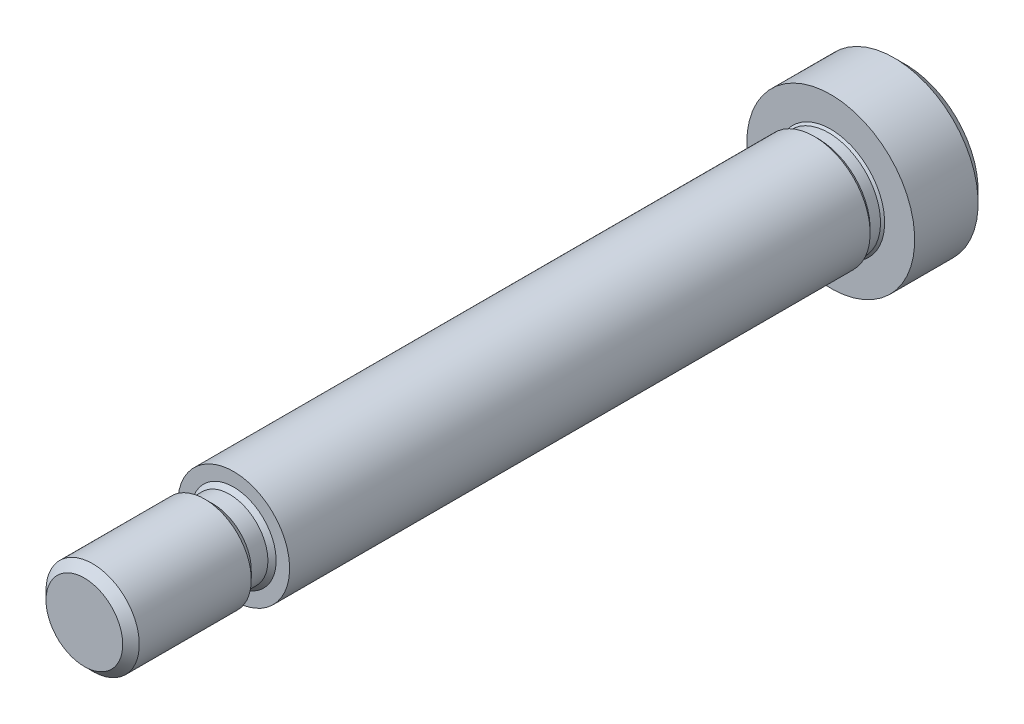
SolidWorks part; units mm, degrees
ref_plane "Front" through (0, 0, 0) normal (0, 0, 1) x (1, 0, 0)
ref_plane "Top" through (0, 0, 0) normal (0, 1, 0) x (1, 0, 0)
ref_plane "Right" through (0, 0, 0) normal (1, 0, 0) x (0, 0, -1)
sketch "Logo3_Revol_Axis" plane through (0, 0, 0) normal (0, 1, 0) x (1, 0, 0)
  line L0 (0, -25.3777) -> (0, 25.3777) construction
sketch "Logo3_bib1" plane through (0, 0, 0) normal (0, -1, 0) x (-1, 0, 0)
  line L0 (0, 62.3527) -> (0, -65.5595) construction
  line L1 (4.7625, 0) -> (3.6163, 0)
  line L2 (4.7625, 0) -> (4.7625, 49.3903)
  line L3 (4.7625, 49.3903) -> (4.4101, 49.7427)
  line L4 (7.1438, 56.1975) -> (6.1913, 57.15)
  line L5 (4.5863, 50.8) -> (7.1438, 50.8)
  line L6 (7.1438, 50.8) -> (7.1438, 56.1975)
  line L7 (6.1913, 57.15) -> (0, 57.15)
  line L8 (4.4101, 49.7427) -> (4.4101, 50.6238)
  line L9 (3.9688, -2.467) -> (3.9688, -11.9951)
  line L11 (3.9688, -11.9951) -> (3.2639, -12.7)
  line L12 (3.2639, -12.7) -> (0, -12.7)
  line L13 (0, -12.7) -> (0, 57.15)
  line L14 (3.2639, -0.3524) -> (3.2639, -1.7621)
  line L15 (3.2639, -1.7621) -> (3.9688, -2.467)
  line L16 (4.4101, 50.6238) -> (4.5863, 50.8)
  line L17 (3.2639, -0.3524) -> (3.6163, 0)
  point P18 (7.1438, 57.15)
revolve "Revolve1" add sketch "Logo3_bib1" angle 360 about L0
sketch "Logo3_bib2" plane through (0, 0, -57.15) normal (0, 0, -1) x (1, 0, 0)
  line L1 (2.7496, 0) -> (1.3748, 2.3813)
  line L2 (1.3748, 2.3813) -> (-1.3748, 2.3813)
  line L3 (-1.3748, 2.3813) -> (-2.7496, 0)
  line L4 (-2.7496, 0) -> (-1.3748, -2.3812)
  line L5 (-1.3748, -2.3812) -> (1.3748, -2.3812)
  line L6 (1.3748, -2.3812) -> (2.7496, 0)
  circle A0 centre (0, 0) radius 2.3812 construction
  dimension "Logo3_c1" = 4.7625
extrude "Cut-Extrude1" cut sketch "Logo3_bib2" against normal blind 4.2333
equation "\"D2@Cosmetic Thread1\" = \"Logo3_dm-pas@Logo3_bib1\""
